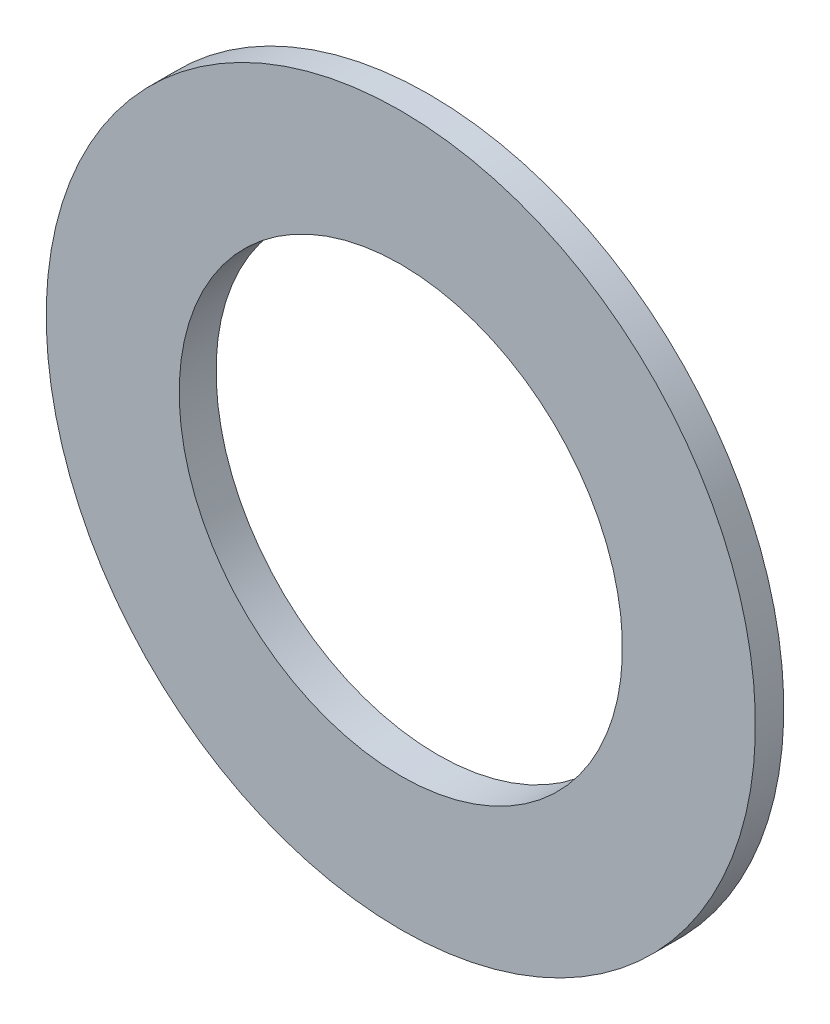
SolidWorks part; units mm, degrees
ref_plane "Front Plane" through (0, 0, 0) normal (0, 0, 1) x (1, 0, 0)
ref_plane "Top Plane" through (0, 0, 0) normal (0, 1, 0) x (1, 0, 0)
ref_plane "Right Plane" through (0, 0, 0) normal (1, 0, 0) x (0, 0, -1)
sketch "Sketch4" plane through (0, 0, 0) normal (1, 0, 0) x (0, 0, -1)
  line L0 (-57.986, 0) -> (41.5964, 0) construction
  line L1 (0, 0) -> (-3.175, 0)
  line L2 (-3.175, 0) -> (-3.175, 22.225)
  line L3 (-1.2268, 22.225) -> (-3.175, 22.225)
  arc A0 (-1.2268, 22.225) -> (0, 0) centre (-201.93, 0) cw
  dimension "D1" = 201.93
  dimension "D3" = 44.45
  dimension "D4" = 3.175
revolve "Revolve1" add sketch "Sketch4" angle 360 about L0
hole_wizard "1 Clearance Hole1" positions "Sketch6" profile "Sketch5" hole size "1" standard "Ansi Inch"
sketch "Sketch6" plane through (0, 0, 3.175) normal (0, 0, 1) x (1, 0, 0)
  point P0 (0, 0)
sketch "Sketch5" plane through (0, 0, 3.175) normal (1, 0, 0) x (0, -1, 0)
  line L0 (0, 0) -> (0, 3.175)
  line L1 (0, 3.175) -> (13.0962, 3.175)
  line L2 (13.0962, 3.175) -> (13.0962, 0)
  line L5 (13.0962, 0) -> (0, 0)
  line L11 (0, -6.35) -> (0, 107.95) construction
  dimension "Thru Hole Dia." = 26.1925
  dimension "Thru Hole Depth" = 3.175
hole_wizard "3/4 Clearance Hole1" positions "Sketch8" profile "Sketch7" hole size "3/4" standard "Ansi Inch"
sketch "Sketch8" plane through (0, 0, 3.175) normal (0, 0, 1) x (1, 0, 0)
  point P0 (0, 0)
sketch "Sketch7" plane through (0, 0, 3.175) normal (1, 0, 0) x (0, -1, 0)
  line L0 (0, 0) -> (0, 11.8033)
  line L1 (0, 11.8033) -> (9.9212, 5.842)
  line L2 (9.9212, 5.842) -> (9.9212, 0)
  line L5 (9.9212, 0) -> (0, 0)
  line L10 (0, 11.8033) -> (-9.9212, 5.842) construction
  line L11 (0, -6.35) -> (0, 107.95) construction
  dimension "Hole Dia." = 19.8425
  dimension "Hole Depth" = 5.842
  dimension "Drill Angle" = 118
hole_wizard "7/16 Clearance Hole1" positions "Sketch10" profile "Sketch9" hole size "7/16" standard "Ansi Inch"
sketch "Sketch10" plane through (0, 0, 3.175) normal (0, 0, 1) x (1, 0, 0)
  point P0 (0, 0)
sketch "Sketch9" plane through (0, 0, 3.175) normal (1, 0, 0) x (0, -1, 0)
  line L0 (0, 0) -> (0, 3.175)
  line L1 (0, 3.175) -> (5.9525, 3.175)
  line L2 (5.9525, 3.175) -> (5.9525, 0)
  line L5 (5.9525, 0) -> (0, 0)
  line L11 (0, -6.35) -> (0, 107.95) construction
  dimension "Thru Hole Dia." = 11.905
  dimension "Thru Hole Depth" = 3.175
sketch "Sketch11" plane through (0, 0, 3.175) normal (0, 0, 1) x (1, 0, 0)
  circle A0 centre (0, 0) radius 15.875
  circle A1 centre (0, 0) radius 26.9715
  dimension "D1" = 31.75
extrude "Cut-Extrude1" cut sketch "Sketch11" against normal through all
sketch "Sketch12" plane through (0, 0, 0) normal (1, 0, 0) x (0, 0, -1)
  line L0 (-0.625, 15.875) -> (-0.625, -15.875) construction
  line L1 (-4.2867, 18.4839) -> (-1.895, 18.4839)
  line L2 (-4.2867, 18.4839) -> (-4.2867, -19.9917)
  line L3 (-4.2867, -19.9917) -> (-1.895, -19.9917)
  line L4 (-1.895, 18.4839) -> (-1.895, -19.9917)
  dimension "D1" = 1.27
extrude "Cut-Extrude2" cut sketch "Sketch12" against normal mid plane 50.8
